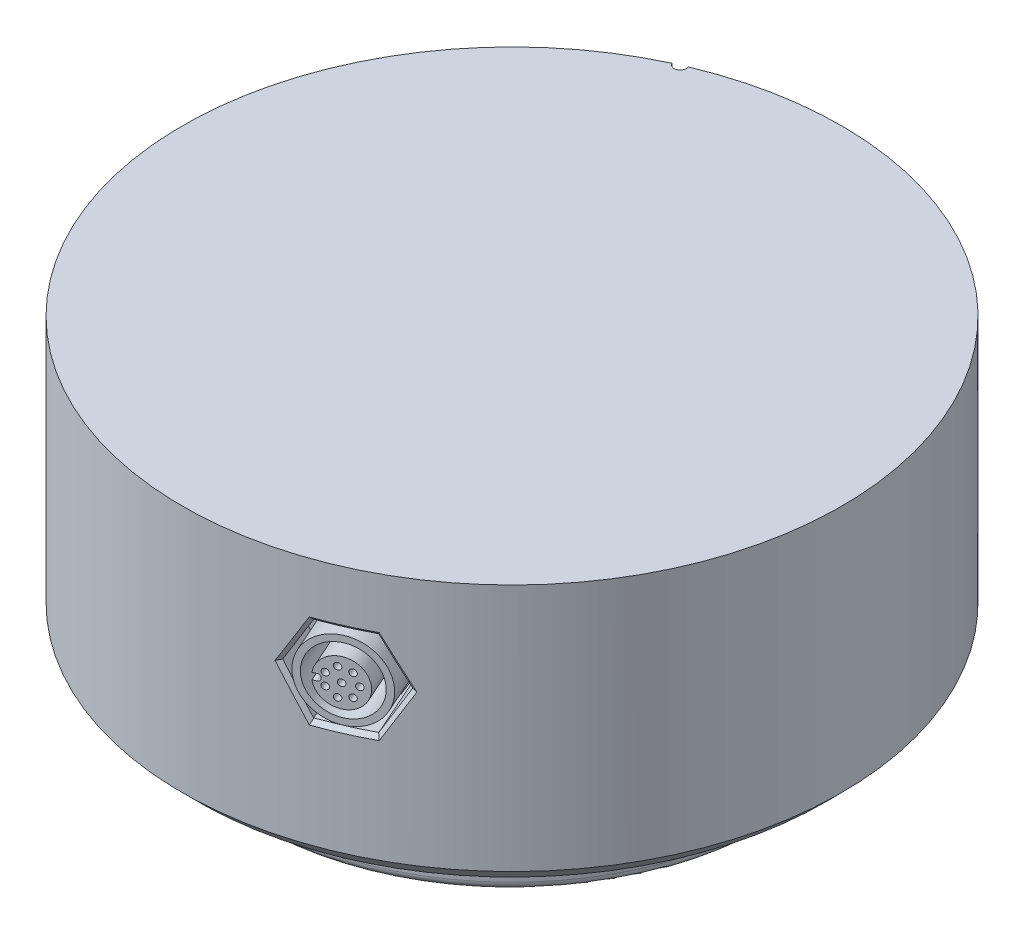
SolidWorks part; units mm, degrees
ref_plane "前视基准面" through (0, 0, 0) normal (0, 0, 1) x (1, 0, 0)
ref_plane "上视基准面" through (0, 0, 0) normal (0, 1, 0) x (1, 0, 0)
ref_plane "右视基准面" through (0, 0, 0) normal (1, 0, 0) x (0, 0, -1)
imported_body "01"
imported_body "02"
sketch "草图1" plane through (0, 39, 0) normal (0, 1, 0) x (1, 0, 0)
  line L0 (-151.2316, -28.7296) -> (-184.9592, 47.5676) construction
  line L1 (-153.7797, -29.855) -> (-148.6834, -27.6042) construction
  circle A0 centre (-184.1831, 45.812) radius 0.75
  circle A1 centre (-167.8084, 8.7699) radius 40.5 construction
  dimension "D1" = 1.5
extrude "切除-拉伸1" cut sketch "草图1" against normal blind 3
